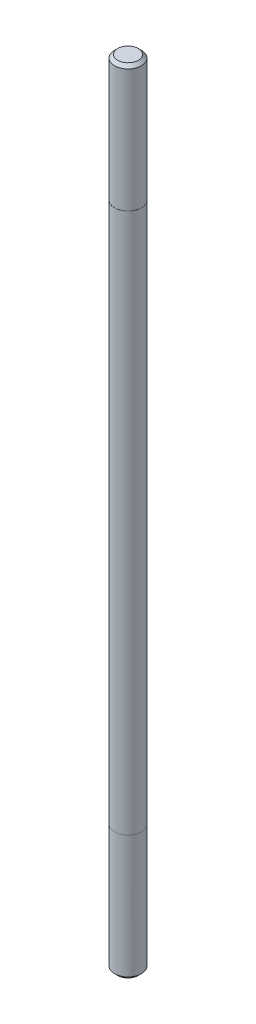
SolidWorks part; units mm, degrees
ref_plane "Front" through (0, 0, 0) normal (0, 0, 1) x (1, 0, 0)
ref_plane "Top" through (0, 0, 0) normal (0, 1, 0) x (1, 0, 0)
ref_plane "Right" through (0, 0, 0) normal (1, 0, 0) x (0, 0, -1)
sketch "Sketch1" plane through (0, 0, 0) normal (0, 1, 0) x (1, 0, 0)
  circle A0 centre (0, 0) radius 1.5
extrude "Extrude1" add sketch "Sketch1" along normal blind 60
sketch "Sketch2" plane through (0, 60, 0) normal (0, 1, 0) x (-1, 0, 0)
  circle A0 centre (0, 0) radius 1.49
extrude "Extrude2" add sketch "Sketch2" along normal blind 14
sketch "Sketch3" plane through (0, 0, 0) normal (0, -1, 0) x (1, 0, 0)
  circle A0 centre (0, 0) radius 1.49
extrude "Extrude3" add sketch "Sketch3" along normal blind 14
chamfer "Chamfer1" distance 0.35 angle 45 2 edges at (0, -14, -1.49) (0, 74, 1.49)
